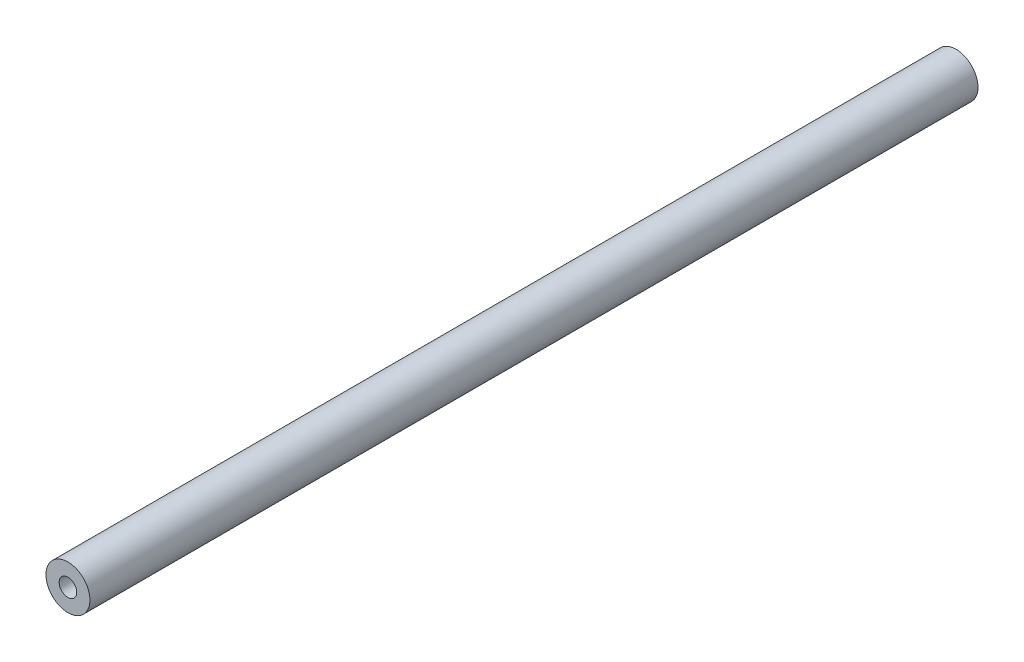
SolidWorks part; units mm, degrees
ref_plane "Front Plane" through (0, 0, 0) normal (0, 0, 1) x (1, 0, 0)
ref_plane "Top Plane" through (0, 0, 0) normal (0, 1, 0) x (1, 0, 0)
ref_plane "Right Plane" through (0, 0, 0) normal (1, 0, 0) x (0, 0, -1)
sketch "Sketch1" plane through (0, 0, 0) normal (0, 0, 1) x (1, 0, 0)
  circle A0 centre (0, 0) radius 5
extrude "Boss-Extrude1" add sketch "Sketch1" along normal blind 202
sketch "Sketch2" plane through (0, 0, 202) normal (0, 0, 1) x (1, 0, 0)
  circle A0 centre (0, 0) radius 2
extrude "Cut-Extrude1" cut sketch "Sketch2" against normal blind 25
sketch "Sketch3" plane through (0, 0, 0) normal (0, 0, -1) x (-1, 0, 0)
  circle A0 centre (0, 0) radius 2
extrude "Cut-Extrude2" cut sketch "Sketch3" against normal blind 25
